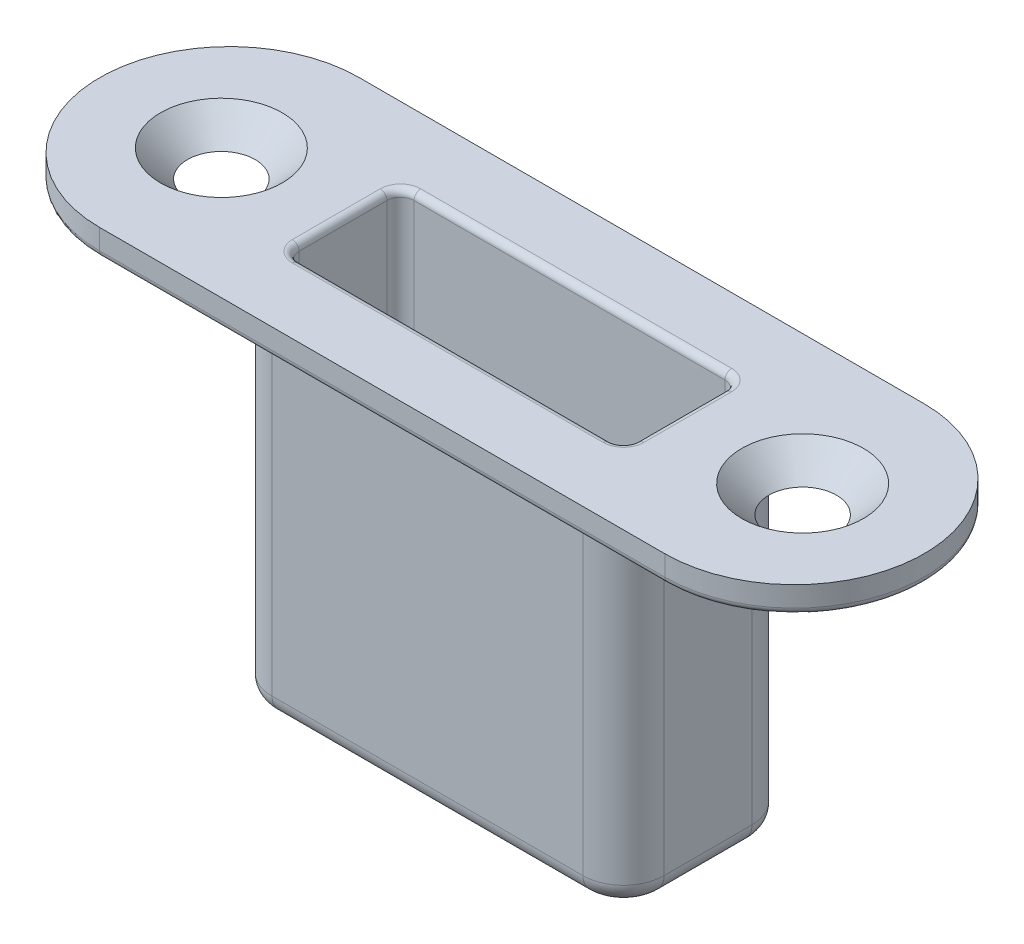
SolidWorks part; units mm, degrees
ref_plane "Front" through (0, 0, 0) normal (0, 0, 1) x (1, 0, 0)
ref_plane "Top" through (0, 0, 0) normal (0, 1, 0) x (1, 0, 0)
ref_plane "Right" through (0, 0, 0) normal (1, 0, 0) x (0, 0, -1)
sketch "Sketch1" plane through (0, 0, 0) normal (0, 1, 0) x (1, 0, 0)
  line L0 (-89.0227, 0) -> (77.7946, 0) construction
  line L1 (20.9, 9.6) -> (-20.9, 9.6)
  line L2 (-20.9, -9.6) -> (20.9, -9.6)
  line L3 (0, 45.3935) -> (0, -48.9224) construction
  line L4 (89.0227, 0) -> (-77.7946, 0) construction
  arc A0 (-20.9, 9.6) -> (-20.9, -9.6) centre (-20.9, 0) ccw
  arc A1 (20.9, 9.6) -> (20.9, -9.6) centre (20.9, 0) cw
  point P9 (0, 9.6)
  point P15 (0, -9.6)
  dimension "D1" = 9.6
  dimension "D2" = 61
extrude "Extrude1" add sketch "Sketch1" against normal blind 2
sketch "Sketch2" plane through (0, 0, 0) normal (0, 1, 0) x (-1, 0, 0)
  line L0 (-31.8747, 0) -> (31.774, 0) construction
  line L1 (8.25, 6.25) -> (-8.25, 6.25)
  line L2 (-8.25, -6.25) -> (8.25, -6.25)
  line L3 (0, -14.4297) -> (0, 13.9947) construction
  line L4 (14.5, 0) -> (14.5, -3.25)
  line L5 (11.5, -6.25) -> (8.25, -6.25)
  line L6 (14.5, 0) -> (14.5, 3.25)
  line L7 (11.5, 6.25) -> (8.25, 6.25)
  line L8 (-8.25, -6.25) -> (-11.5, -6.25)
  line L9 (-14.5, 0) -> (-14.5, -3.25)
  line L10 (-14.5, 0) -> (-14.5, 3.25)
  line L11 (-11.5, 6.25) -> (-8.25, 6.25)
  arc A0 (-8.25, 6.25) -> (-8.25, -6.25) centre (-8.25, 0) ccw construction
  arc A1 (8.25, 6.25) -> (8.25, -6.25) centre (8.25, 0) cw construction
  arc A2 (-11.5, -6.25) -> (-14.5, -3.25) centre (-11.5, -3.25) cw
  arc A3 (-14.5, 3.25) -> (-11.5, 6.25) centre (-11.5, 3.25) cw
  arc A4 (11.5, 6.25) -> (14.5, 3.25) centre (11.5, 3.25) cw
  arc A5 (14.5, -3.25) -> (11.5, -6.25) centre (11.5, -3.25) cw
  point P9 (0, 6.25)
  point P13 (0, -6.25)
  dimension "D2" = 29
  dimension "D3" = 3
  dimension "D1" = 12.5
extrude "Extrude2" add sketch "Sketch2" against normal blind 28.5
sketch "Sketch3" plane through (0, 0, 0) normal (0, 1, 0) x (1, 0, 0)
  line L0 (-30.5, 0) -> (29.1441, 0) construction
  line L1 (-12.5, 3.25) -> (-12.5, 0)
  line L2 (-12.5, 0) -> (-12.5, -3.25)
  line L3 (-11.5, -4.25) -> (-8.25, -4.25)
  line L4 (-8.25, -4.25) -> (8.25, -4.25)
  line L5 (8.25, -4.25) -> (11.5, -4.25)
  line L6 (12.5, -3.25) -> (12.5, 0)
  line L7 (12.5, 0) -> (12.5, 3.25)
  line L8 (11.5, 4.25) -> (8.25, 4.25)
  line L9 (8.25, 4.25) -> (-8.25, 4.25)
  line L10 (-8.25, 4.25) -> (-11.5, 4.25)
  line L11 (-14.5, 3.25) -> (-14.5, 0)
  line L12 (-14.5, 0) -> (-14.5, -3.25)
  line L13 (-11.5, -6.25) -> (-8.25, -6.25)
  line L14 (-8.25, -6.25) -> (8.25, -6.25)
  line L15 (8.25, -6.25) -> (11.5, -6.25)
  line L16 (14.5, -3.25) -> (14.5, 0)
  line L17 (14.5, 0) -> (14.5, 3.25)
  line L18 (11.5, 6.25) -> (8.25, 6.25)
  line L19 (8.25, 6.25) -> (-8.25, 6.25)
  line L20 (-8.25, 6.25) -> (-11.5, 6.25)
  line L21 (-14.5, 3.25) -> (-14.5, 0) construction
  line L22 (-14.5, 0) -> (-14.5, -3.25) construction
  line L23 (-11.5, -6.25) -> (-8.25, -6.25) construction
  line L24 (-8.25, -6.25) -> (8.25, -6.25) construction
  line L25 (8.25, -6.25) -> (11.5, -6.25) construction
  line L26 (14.5, -3.25) -> (14.5, 0) construction
  line L27 (14.5, 0) -> (14.5, 3.25) construction
  line L28 (11.5, 6.25) -> (8.25, 6.25) construction
  line L29 (8.25, 6.25) -> (-8.25, 6.25) construction
  line L30 (-8.25, 6.25) -> (-11.5, 6.25) construction
  arc A0 (-20.9, 9.6) -> (-20.9, -9.6) centre (-20.9, 0) ccw construction
  arc A1 (-12.5, -3.25) -> (-11.5, -4.25) centre (-11.5, -3.25) ccw
  arc A2 (11.5, -4.25) -> (12.5, -3.25) centre (11.5, -3.25) ccw
  arc A3 (12.5, 3.25) -> (11.5, 4.25) centre (11.5, 3.25) ccw
  arc A4 (-11.5, 4.25) -> (-12.5, 3.25) centre (-11.5, 3.25) ccw
  arc A5 (-14.5, -3.25) -> (-11.5, -6.25) centre (-11.5, -3.25) ccw
  arc A6 (11.5, -6.25) -> (14.5, -3.25) centre (11.5, -3.25) ccw
  arc A7 (14.5, 3.25) -> (11.5, 6.25) centre (11.5, 3.25) ccw
  arc A8 (-11.5, 6.25) -> (-14.5, 3.25) centre (-11.5, 3.25) ccw
  arc A9 (-14.5, -3.25) -> (-11.5, -6.25) centre (-11.5, -3.25) ccw construction
  arc A10 (11.5, -6.25) -> (14.5, -3.25) centre (11.5, -3.25) ccw construction
  arc A11 (14.5, 3.25) -> (11.5, 6.25) centre (11.5, 3.25) ccw construction
  arc A12 (-11.5, 6.25) -> (-14.5, 3.25) centre (-11.5, 3.25) ccw construction
  dimension "D1" = 0
  dimension "D2" = 2
extrude "Cut-Extrude1" cut sketch "Sketch3" against normal blind 26.5
fillet "Fillet1" radius 0.25 8 edges at (0, -2, -6.25) (0, -2, 6.25) (-13.6213, -2, 5.3713) (-14.5, -2, 0) (-13.6213, -2, -5.3713) (13.6213, -2, -5.3713) (14.5, -2, 0) (13.6213, -2, 5.3713)
fillet "Fillet3" radius 0.5 20 edges at (0, -26.5, -4.25) (12.2071, -26.5, -3.9571) (12.5, -26.5, 0) (12.2071, -26.5, 3.9571) (0, -26.5, 4.25) (-12.2071, -26.5, 3.9571) (-12.5, -26.5, 0) (-12.2071, -26.5, -3.9571) (12.2071, 0, -3.9571) (12.5, 0, 0) (12.2071, 0, 3.9571) (0, 0, 4.25) (-12.2071, 0, 3.9571) (-12.5, 0, 0) (-12.2071, 0, -3.9571) (0, 0, -4.25) (0, -2, -9.6) (30.5, -2, 0) (0, -2, 9.6) (-30.5, -2, 0)
fillet "Fillet4" radius 1.5 8 edges at (-13.6213, -28.5, 5.3713) (-14.5, -28.5, 0) (-13.6213, -28.5, -5.3713) (0, -28.5, -6.25) (13.6213, -28.5, -5.3713) (14.5, -28.5, 0) (13.6213, -28.5, 5.3713) (0, -28.5, 6.25)
sketch "Sketch4" plane through (0, 0, 0) normal (0, 1, 0) x (1, 0, 0)
  line L0 (-32.3348, 0) -> (32.4904, 0) construction
  line L1 (0, -1.9066) -> (0, 3.1518) construction
  circle A0 centre (-21.5, 0) radius 2.5
  circle A1 centre (21.5, 0) radius 2.5
  arc A3 (-20.9, 9.6) -> (-20.9, -9.6) centre (-20.9, 0) ccw construction
  dimension "D2" = 5
  dimension "D1" = 9
extrude "Cut-Extrude2" cut sketch "Sketch4" against normal through all
chamfer "Chamfer1" distance 2 angle 45 2 edges at (21.5, 0, -2.5) (-21.5, 0, 2.5)
